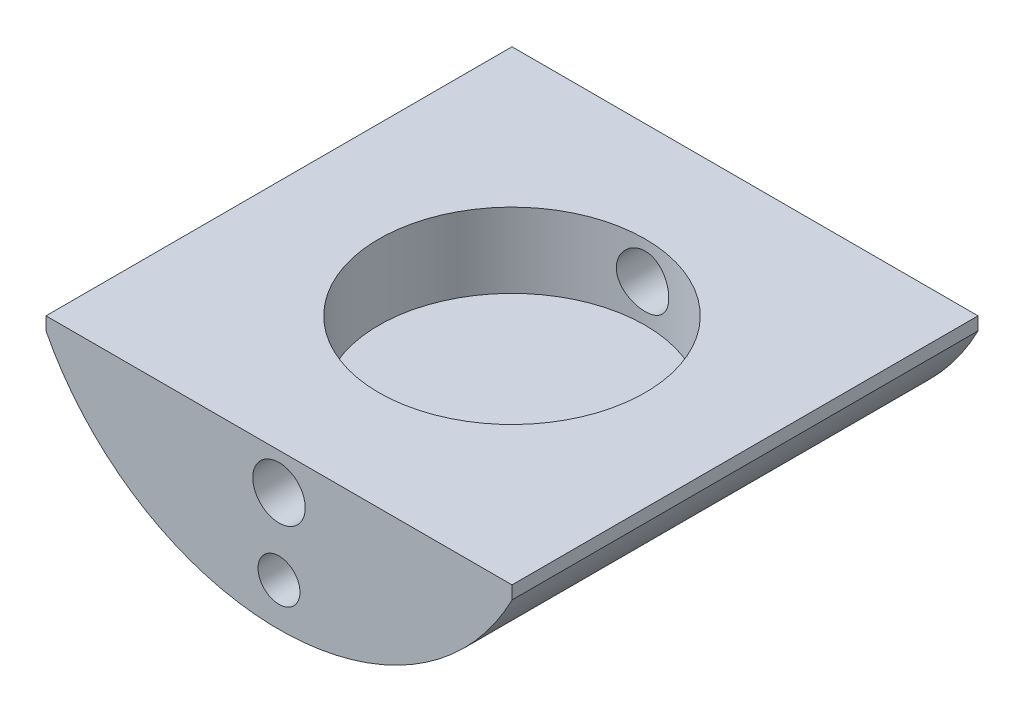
SolidWorks part; units mm, degrees
ref_plane "Front Plane" through (0, 0, 0) normal (0, 0, 1) x (1, 0, 0)
ref_plane "Top Plane" through (0, 0, 0) normal (0, 1, 0) x (1, 0, 0)
ref_plane "Right Plane" through (0, 0, 0) normal (1, 0, 0) x (0, 0, -1)
sketch "Sketch1" plane through (0, 0, 0) normal (0, 0, 1) x (1, 0, 0)
  line L0 (-44.45, -2.5) -> (-44.45, 0)
  line L1 (-44.45, 0) -> (44.45, 0)
  line L2 (44.45, 0) -> (44.45, -2.5)
  line L3 (0, 0) -> (0, 42.292) construction
  arc A0 (-44.45, -2.5) -> (44.45, -2.5) centre (0, 20.3954) ccw
  dimension "D1" = 50
  dimension "D2" = 2.5
  dimension "D3" = 88.9
extrude "Boss-Extrude1" add sketch "Sketch1" along normal mid plane 88.9
sketch "Sketch2" plane through (0, 0, 0) normal (0, 1, 0) x (1, 0, 0)
  circle A0 centre (0, 0) radius 25.4
  dimension "D1" = 50.8
extrude "Cut-Extrude1" cut sketch "Sketch2" against normal blind 14.25
hole_wizard "Ø10.0 (10) Diameter Hole1" positions "Sketch4" profile "Sketch3" hole size "Ø10.0" standard "ANSI Metric"
sketch "Sketch4" plane through (0, 0, 44.45) normal (0, 0, 1) x (1, 0, 0)
  line L0 (44.45, 0) -> (-44.45, 0) construction
  line L2 (0, 0) -> (0, -36.7389) construction
  point P0 (0, -7)
  dimension "D1" = 7
sketch "Sketch3" plane through (0, -7, 44.45) normal (1, 0, 0) x (0, -1, 0)
  line L0 (0, 0) -> (0, 88.9)
  line L1 (0, 88.9) -> (5, 88.9)
  line L2 (5, 88.9) -> (5, 0)
  line L5 (5, 0) -> (0, 0)
  line L11 (0, -6.35) -> (0, 107.95) construction
  dimension "Thru Hole Dia." = 10
  dimension "Thru Hole Depth" = 88.9
hole_wizard "Ø8.0 (8) Diameter Hole1" positions "Sketch6" profile "Sketch5" hole size "Ø8.0" standard "ANSI Metric"
sketch "Sketch6" plane through (0, 0, 44.45) normal (0, 0, 1) x (1, 0, 0)
  line L0 (44.45, 0) -> (-44.45, 0) construction
  point P0 (0, -21.45)
  dimension "D1" = 21.45
sketch "Sketch5" plane through (0, -21.45, 44.45) normal (1, 0, 0) x (0, -1, 0)
  line L0 (0, 0) -> (0, 17.5)
  line L1 (0, 17.5) -> (4, 17.5)
  line L2 (4, 17.5) -> (4, 0)
  line L5 (4, 0) -> (0, 0)
  line L10 (0, 17.5) -> (-4, 17.5) construction
  line L11 (0, -6.35) -> (0, 107.95) construction
  dimension "Hole Dia." = 8
  dimension "Hole Depth" = 17.5
  dimension "Drill Angle" = 180
mirror "Mirror1" about plane through (0, 0, 0) normal (0, 0, 1) of "Ø8.0 (8) Diameter Hole1"
